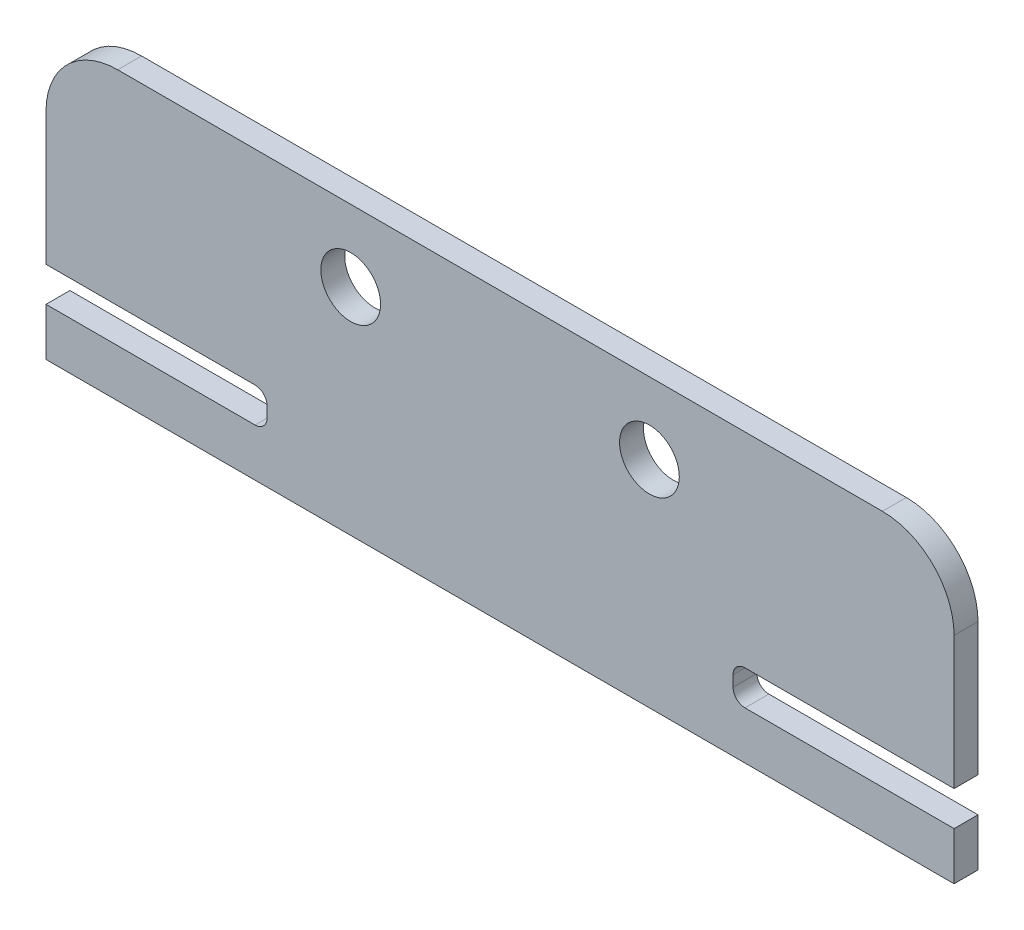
SolidWorks part; units mm, degrees
ref_plane "Front Plane" through (0, 0, 0) normal (0, 0, 1) x (1, 0, 0)
ref_plane "Top Plane" through (0, 0, 0) normal (0, 1, 0) x (1, 0, 0)
ref_plane "Right Plane" through (0, 0, 0) normal (1, 0, 0) x (0, 0, -1)
sketch "Sketch1" plane through (0, 0, 0) normal (0, 0, 1) x (1, 0, 0)
  line L1 (-279.4, 76.2) -> (279.4, 76.2)
  line L2 (-482.6, -177.8) -> (-482.6, -228.6)
  line L3 (-279.4, 76.2) -> (-482.6, 76.2)
  line L4 (-482.6, 76.2) -> (-482.6, -140.97)
  line L5 (-247.65, -140.97) -> (-247.65, -177.8)
  line L6 (-482.6, -140.97) -> (-247.65, -140.97)
  line L7 (-482.6, -228.6) -> (482.6, -228.6)
  line L9 (247.65, -140.97) -> (247.65, -177.8)
  line L10 (482.6, -140.97) -> (247.65, -140.97)
  line L12 (-482.6, -177.8) -> (-247.65, -177.8)
  line L13 (247.65, -177.8) -> (482.6, -177.8)
  line L14 (482.6, 76.2) -> (482.6, -140.97)
  line L15 (279.4, 76.2) -> (482.6, 76.2)
  line L16 (482.6, -177.8) -> (482.6, -228.6)
  circle A0 centre (158.75, 0) radius 31.75
  circle A1 centre (-158.75, 0) radius 31.75
  dimension "D3" = 63.5
  dimension "D4" = 63.5
  dimension "D5" = 76.2
  dimension "D6" = 36.83
  dimension "D14" = 254
  dimension "D13" = 254
  dimension "D11" = 965.2
  dimension "D2" = 482.6
  dimension "D7" = 317.5
  dimension "D8" = 36.83
  dimension "D9" = 234.95
  dimension "D10" = 965.2
  dimension "D12" = 76.2
  dimension "D16" = 234.95
  dimension "D18" = 304.8
extrude "Extrude1" add sketch "Sketch1" along normal blind 25.4
fillet "Fillet1" radius 76.2
fillet "Fillet2" radius 12.7
